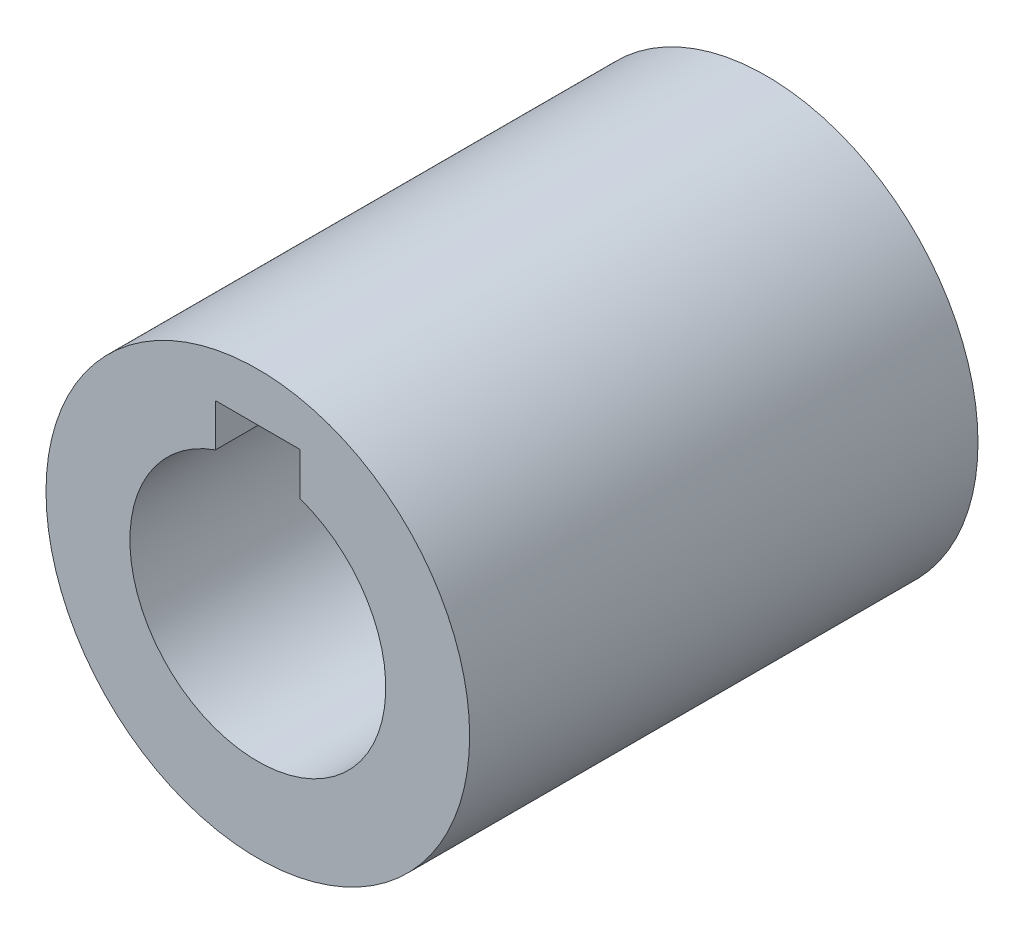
SolidWorks part; units mm, degrees
ref_plane "Front Plane" through (0, 0, 0) normal (0, 0, 1) x (1, 0, 0)
ref_plane "Top Plane" through (0, 0, 0) normal (0, 1, 0) x (1, 0, 0)
ref_plane "Right Plane" through (0, 0, 0) normal (1, 0, 0) x (0, 0, -1)
sketch "Sketch1" plane through (0, 0, 0) normal (0, 0, 1) x (1, 0, 0)
  circle A0 centre (0, 0) radius 15.875
  circle A1 centre (0, 0) radius 9.5885
  dimension "D1" = 19.177
  dimension "D2" = 31.75
extrude "Extrude1" add sketch "Sketch1" along normal mid plane 38.1
sketch "Sketch2" plane through (0, 0, 19.05) normal (0, 0, 1) x (1, 0, 0)
  line L1 (-3.175, 9.0476) -> (3.175, 9.0476)
  line L2 (-3.175, 9.0476) -> (-3.175, 12.248)
  line L3 (-3.175, 12.248) -> (3.175, 12.248)
  line L4 (3.175, 9.0476) -> (3.175, 12.248)
  circle A0 centre (0, 0) radius 9.5885 construction
  dimension "D1" = 6.35
  dimension "D2" = 3.175
  dimension "D3" = 3.2004
  dimension "D4" = 12.248
extrude "Cut-Extrude1" cut sketch "Sketch2" against normal through all
